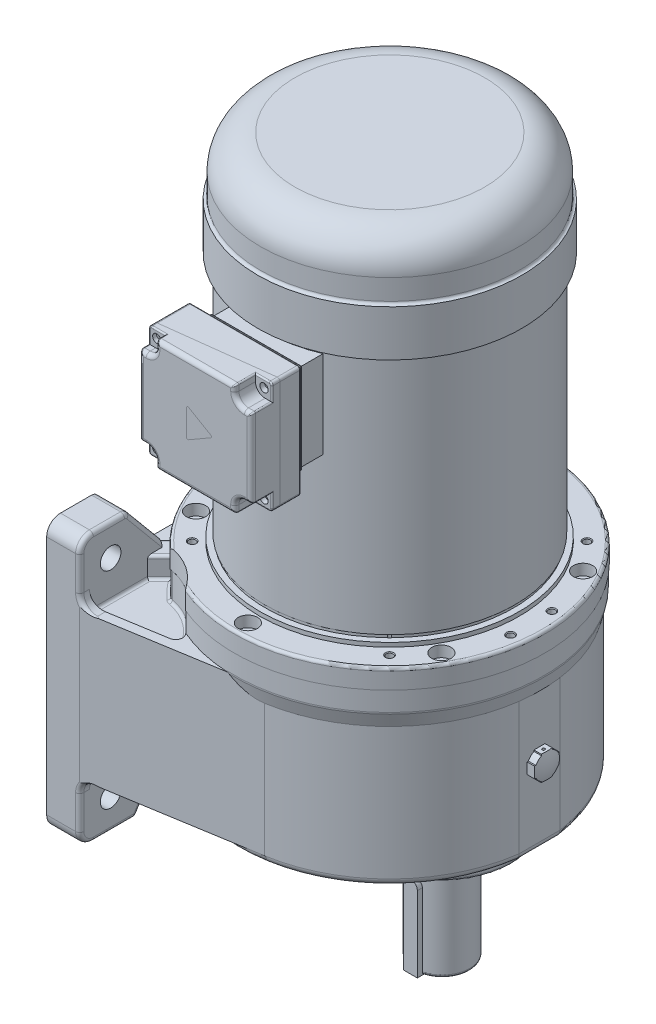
SolidWorks part; units mm, degrees
ref_plane "前视基准面" through (0, 0, 0) normal (0, 0, 1) x (1, 0, 0)
ref_plane "上视基准面" through (0, 0, 0) normal (0, 1, 0) x (1, 0, 0)
ref_plane "右视基准面" through (0, 0, 0) normal (1, 0, 0) x (0, 0, -1)
imported_body "接线盒座-1-surface1"
imported_body "接线盒座-1-surface2"
imported_body "接线盒座-1-surface3"
imported_body "接线盒座-1-surface4"
imported_body "接线盒座-1-surface5"
imported_body "接线盒座-1-surface6"
imported_body "接线盒盖-1-surface1"
imported_body "接线盒盖-1-surface2"
imported_body "15.04.12 40卧式箱体D版-1-surface1"
imported_body "15.04.12 40卧式箱体D版-1-surface2"
imported_body "15.04.12 40卧式箱体D版-1-surface3"
imported_body "15.04.12 40卧式箱体D版-1-surface4"
imported_body "15.07.07 40箱盖(新)-1-surface1"
imported_body "透气塞-1-surface1"
sketch "草图1" plane through (0, -153.476, 0) normal (0, 1, 0) x (1, 0, 0)
  circle A0 centre (162.7199, 75.8671) radius 91
  circle A1 centre (200.7199, 75.8671) radius 38 construction
extrude "凸台-拉伸1" add sketch "草图1" along normal blind 176.5
sketch "草图2" plane through (0, 23.024, 0) normal (0, 1, 0) x (1, 0, 0)
  circle A0 centre (162.7199, 75.8671) radius 96
extrude "凸台-拉伸2" add sketch "草图2" along normal blind 33.5
sketch "草图3" plane through (0, 56.524, 0) normal (0, 1, 0) x (1, 0, 0)
  circle A0 centre (162.7199, 75.8671) radius 94
extrude "凸台-拉伸3" add sketch "草图3" along normal blind 42
fillet "圆角1" radius 25 1 edges at (162.7199, 98.524, 18.1329)
fillet "圆角2" radius 2 1 edges at (162.7199, 56.524, 18.1329)
